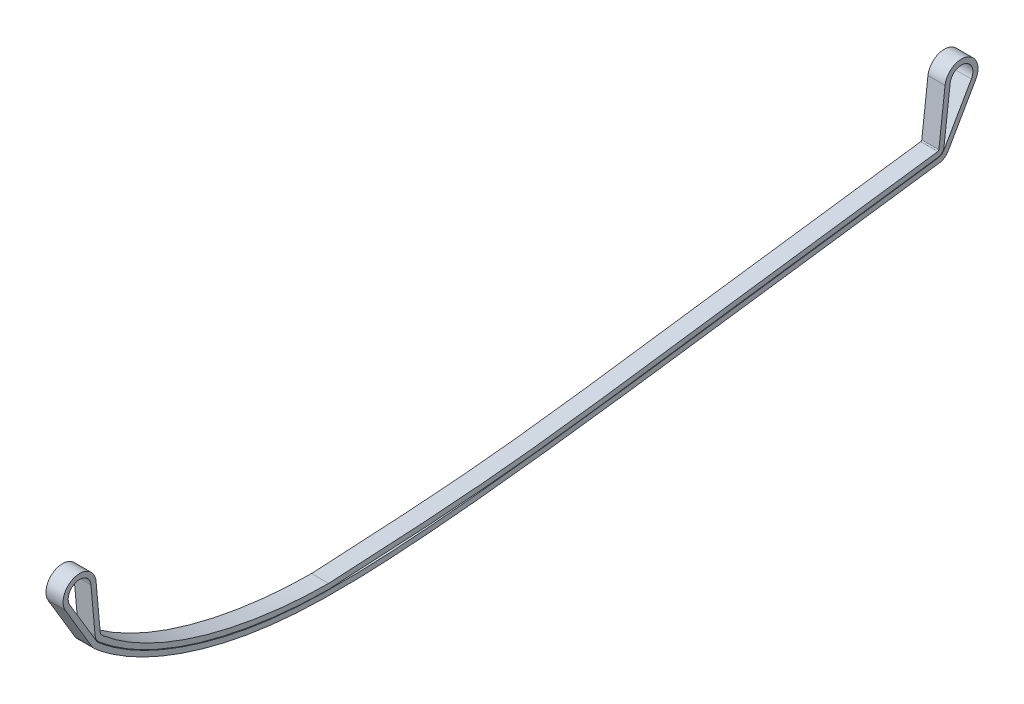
SolidWorks part; units mm, degrees
ref_plane "Plan de face" through (0, 0, 0) normal (0, 0, 1) x (1, 0, 0)
ref_plane "Plan de dessus" through (0, 0, 0) normal (0, 1, 0) x (1, 0, 0)
ref_plane "Plan de droite" through (0, 0, 0) normal (1, 0, 0) x (0, 0, -1)
sketch "Esquisse1" plane through (0, 0, 0) normal (1, 0, 0) x (0, 0, -1)
  line L0 (-79.0921, 0) -> (468.674, 0) construction
  line L1 (0, -36.2431) -> (0, 12.8928) construction
  line L2 (-0.5, 12.8928) -> (-0.5, -6.3623) construction
  line L3 (147.5, 12.8928) -> (147.5, -3.2082) construction
  line L4 (147.5071, 0.0606) -> (148.5962, 9.2941)
  line L5 (-0.5359, 0.4007) -> (-1.2548, 8.4208)
  line L6 (-5.7979, 6.945) -> (-1.174, -0.7905)
  line L7 (153.1544, 7.7879) -> (148.292, -0.6867)
  line L8 (40, -12.267) -> (40, -24.6928) construction
  line L30 (147, 12.8928) -> (147, -36.2431) construction
  arc A0 (153.1544, 7.7879) -> (148.5962, 9.2941) centre (151.0293, 9.0071) ccw
  arc A1 (146.9462, -0.5123) -> (147.5071, 0.0606) centre (146.8556, 0.1374) ccw
  arc A2 (-1.2548, 8.4208) -> (-5.7979, 6.945) centre (-3.695, 8.2021) ccw
  arc A3 (-1.174, -0.7905) -> (-0.6158, -1.4463) centre (1.0577, 0.5435) ccw
  arc A4 (-0.5359, 0.4007) -> (0.0279, -0.681) centre (1.0577, 0.5435) ccw
  circle A5 centre (-3.695, 8.2021) radius 1.95 construction
  circle A6 centre (151.0293, 9.0071) radius 1.95 construction
  arc A7 (147.0842, -1.5028) -> (148.292, -0.6867) centre (146.8556, 0.1374) ccw
  spline S0 degree 1 poles (-0.3272, -0.3781) (147.069, -0.4952) knots 0 0 1 1 construction
  spline S1 degree 3 poles (0, 0) (10.007, -8.6609) (26.5253, -12.1435) (52.9297, -12.2542) (89.4971, -8.0131) (124.8289, -3.0896) (147, 0) knots 0 0 0 0 0.279636 0.279636 0.547961 1 1 1 1 construction
  spline S2 degree 3 poles (-0.3272, -0.3781) (0.822, -1.3727) (3.2358, -3.1875) (8.6503, -6.3468) (16.2084, -9.3648) (24.3212, -11.2781) (30.8181, -12.2015) (35.1453, -12.5711) (38.5748, -12.6992) (41.5812, -12.7052) (46.6002, -12.6307) (54.028, -12.2671) (63.402, -11.4492) (72.838, -10.3959) (82.2569, -9.2267) (94.7356, -7.6392) (110.2197, -5.5872) (128.6775, -3.0582) (140.9348, -1.35) (147.069, -0.4952) knots 0 0 0 0 0.03125 0.0625 0.125 0.1875 0.21875 0.25 0.271838 0.287463 0.3125 0.375 0.4375 0.5 0.5625 0.625 0.75 0.875 1 1 1 1 only from (0.0279, -0.681) to (146.9462, -0.5123)
  spline S3 degree 1 poles (-0.9816, -1.1342) (147.207, -1.4856) knots 0 0 1 1 construction
  spline S4 degree 3 poles (-0.9816, -1.1342) (0.1997, -2.1566) (2.6856, -4.0256) (8.2229, -7.255) (15.9149, -10.3249) (25.7706, -12.6456) (34.0065, -13.5695) (40.251, -13.7319) (46.3229, -13.6452) (54.1, -13.265) (63.5024, -12.4442) (72.9575, -11.3888) (82.3816, -10.2189) (94.8648, -8.6308) (110.3536, -6.5782) (128.8149, -4.0487) (141.0725, -2.3405) (147.207, -1.4856) knots 0 0 0 0 0.03125 0.0625 0.125 0.1875 0.25 0.28125 0.3125 0.375 0.4375 0.5 0.5625 0.625 0.75 0.875 1 1 1 1 only from (-0.6158, -1.4463) to (147.0842, -1.5028)
  point P29 (40, -12.7)
  dimension "D4" = 1.5
  dimension "D1" = 0.5
  dimension "D2" = 0.5
  dimension "D3" = 0.5
ref_plane "Plan1" through (0, 0, -40) normal (0, 0, 1) x (1, 0, 0)
sketch "Esquisse3" plane through (0, 0, -40) normal (0, 0, 1) x (1, 0, 0)
  line L0 (-1.0346, 0) -> (0.4176, 0) construction
  line L1 (0, 0.7799) -> (0, -14.3534) construction
  line L2 (0, 7.7879) -> (0, -0.6867) construction
  line L3 (0, -12.2014) -> (0, 0) construction
  line L4 (-1.0346, -12.7) -> (0.4176, -12.7) construction
  line L5 (2.2117, -12.25) -> (-1.7847, -12.25) construction
  line L6 (2.2117, -13.15) -> (-1.8281, -13.15) construction
  line L7 (1.5, -11.2234) -> (1.5, -13.6188) construction
  line L8 (-1.5, -11.2234) -> (-1.5, -13.6188) construction
  line L10 (1.5, -12.25) -> (-1.5, -12.25)
  line L11 (1.5, -12.25) -> (1.5, -13.15)
  line L12 (1.5, -13.15) -> (-1.5, -13.15)
  line L13 (-1.5, -12.25) -> (-1.5, -13.15)
  line L14 (1.5, -12.25) -> (-1.5, -13.15) construction
  line L15 (1.5, -13.15) -> (-1.5, -12.25) construction
  point P19 (0, -12.7)
  dimension "D1" = 12.7
  dimension "D2" = 0.9
  dimension "D3" = 0.45
  dimension "D4" = 3
  dimension "D5" = 1.5
sweep "Balayage4" add profiles "Esquisse3" path "Esquisse1"
